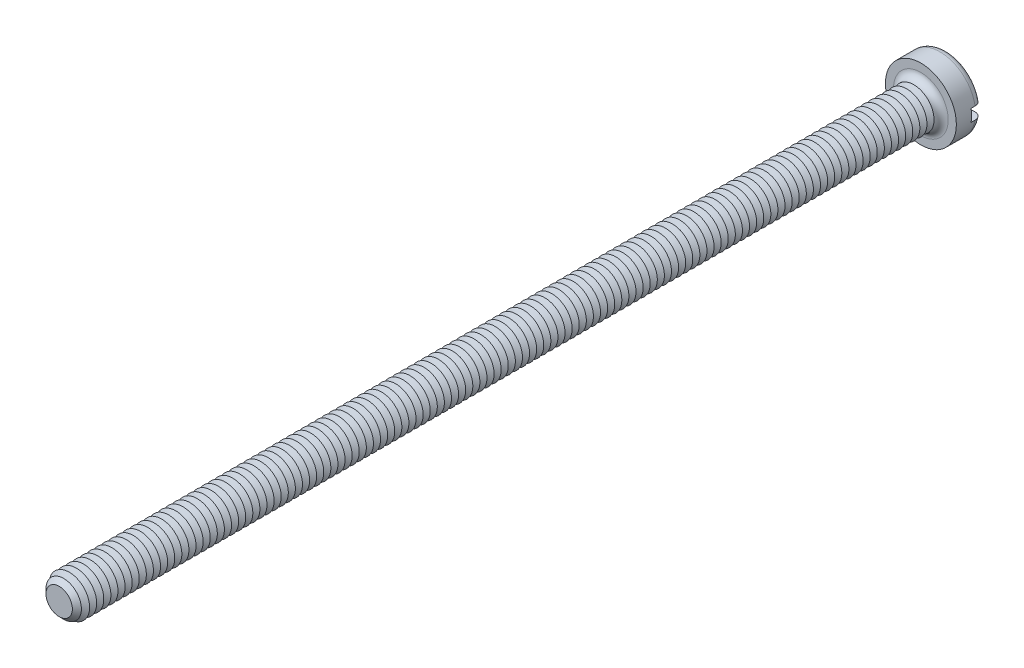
SolidWorks part; units mm, degrees
ref_plane "Front Plane" through (0, 0, 0) normal (0, 0, 1) x (1, 0, 0)
ref_plane "Top Plane" through (0, 0, 0) normal (0, 1, 0) x (1, 0, 0)
ref_plane "Right Plane" through (0, 0, 0) normal (1, 0, 0) x (0, 0, -1)
sketch "Sketch3" plane through (0, 0, 0) normal (0, 0, 1) x (1, 0, 0)
  circle A0 centre (0, 0) radius 3.5
  dimension "D1" = 7
extrude "Boss-Extrude2" add sketch "Sketch3" against normal blind 2.6
sketch "Sketch4" plane through (0, 0, 0) normal (0, 0, 1) x (1, 0, 0)
  circle A0 centre (0, 0) radius 2
  dimension "D1" = 4
extrude "Boss-Extrude3" add sketch "Sketch4" along normal blind 85
fillet "Fillet1" radius 0.7 2 edges at (3.5, 0, -2.6) (2, 0, 0)
chamfer "Chamfer1" distance 0.7 angle 45 1 edges at (2, 0, 85)
sketch "Sketch5" plane through (0, 0, 0) normal (1, 0, 0) x (0, 0, -1)
  line L0 (1.6944, 0) -> (-7.6738, 0) construction
sketch "Sketch6" plane through (0, 0, 0) normal (1, 0, 0) x (0, 0, -1)
  line L0 (-0.7, 2) -> (-1.05, 1.3938)
  line L1 (-1.05, 1.3938) -> (-1.4, 2)
  line L2 (-0.7, 2) -> (-84.3, 2) construction
  line L3 (-1.4, 2) -> (-0.7, 2)
  dimension "D1" = 0.7
revolve "Cut-Revolve1" cut sketch "Sketch6" angle 360 about L0
pattern_linear "LPattern1" count 120 spacing 0.7 along (0, 0, 1) of "Cut-Revolve1"
sketch "Sketch8" plane through (0, 0, -2.6) normal (0, 0, -1) x (-1, 0, 0)
  line L1 (3.5, -0.6) -> (-3.5, -0.6)
  line L2 (3.5, -0.6) -> (3.5, 0.6)
  line L3 (3.5, 0.6) -> (-3.5, 0.6)
  line L4 (-3.5, -0.6) -> (-3.5, 0.6)
  line L5 (3.5, -0.6) -> (-3.5, 0.6) construction
  line L6 (3.5, 0.6) -> (-3.5, -0.6) construction
  point P0 (0, 0)
  dimension "D1" = 7
  dimension "D2" = 1.2
extrude "Cut-Extrude1" cut sketch "Sketch8" against normal blind 1.1
